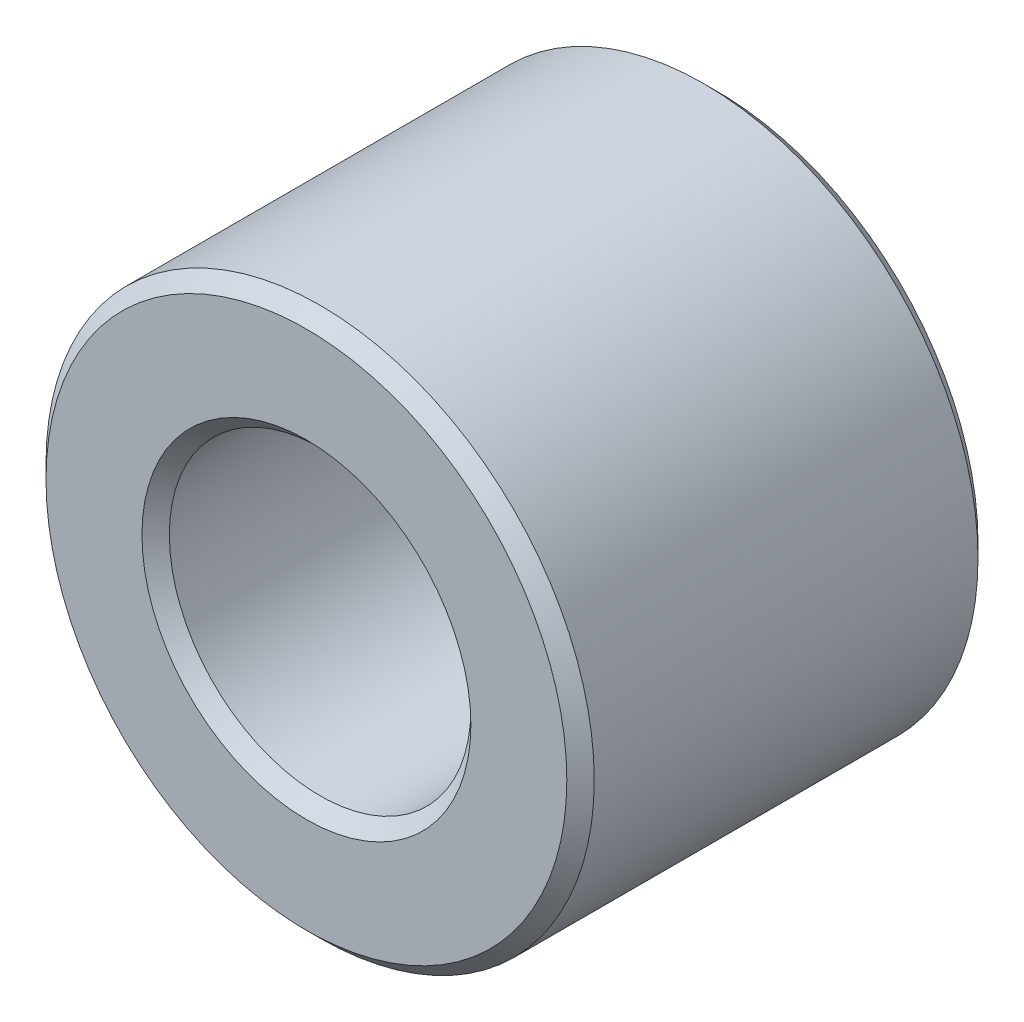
SolidWorks part; units mm, degrees
ref_plane "Front Plane" through (0, 0, 0) normal (0, 0, 1) x (1, 0, 0)
ref_plane "Top Plane" through (0, 0, 0) normal (0, 1, 0) x (1, 0, 0)
ref_plane "Right Plane" through (0, 0, 0) normal (1, 0, 0) x (0, 0, -1)
sketch "Sketch1" plane through (0, 0, 0) normal (0, 0, 1) x (1, 0, 0)
  circle A0 centre (0, 0) radius 2
  circle A1 centre (0, 0) radius 1.1
  dimension "D1" = 4
  dimension "D2" = 2.2
extrude "Boss-Extrude2" add sketch "Sketch1" along normal mid plane 3
chamfer "Chamfer3" distance 0.1 angle 45 4 edges at (2, 0, 1.5) (2, 0, -1.5) (1.1, 0, -1.5) (1.1, 0, 1.5)
